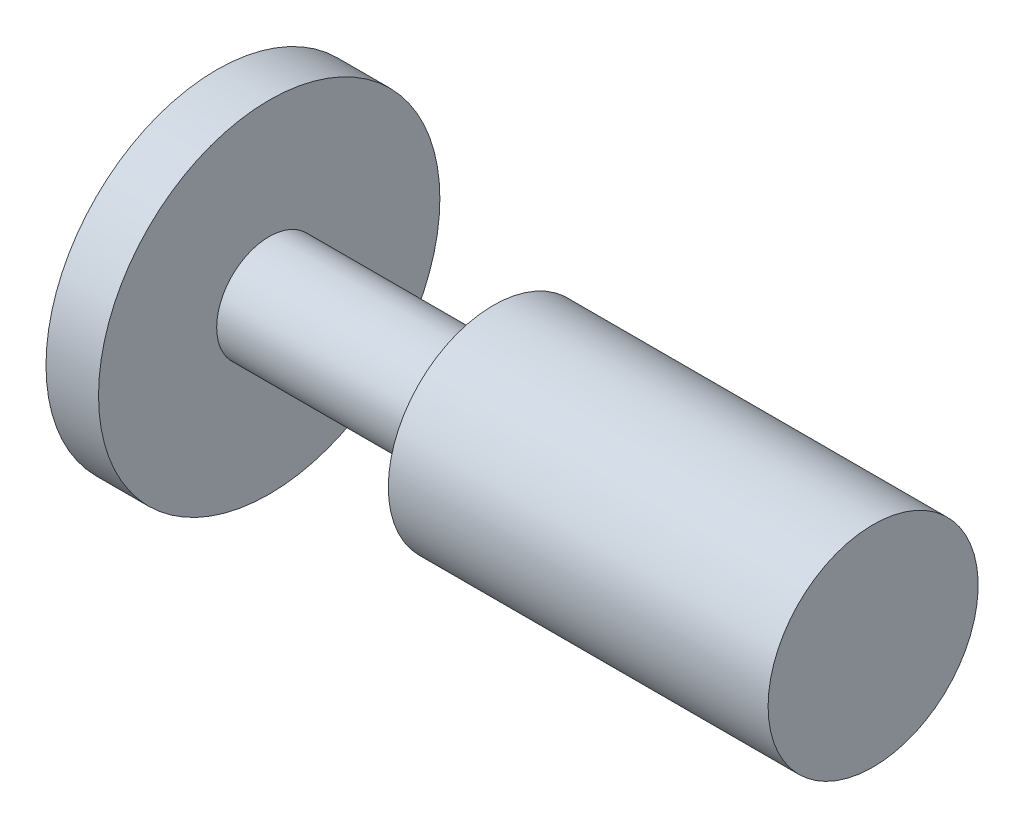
SolidWorks part; units mm, degrees
ref_plane "Plan de face" through (0, 0, 0) normal (0, 0, 1) x (1, 0, 0)
ref_plane "Plan de dessus" through (0, 0, 0) normal (0, 1, 0) x (1, 0, 0)
ref_plane "Plan de droite" through (0, 0, 0) normal (1, 0, 0) x (0, 0, -1)
sketch "Esquisse1" plane through (0, 0, 0) normal (0, 0, 1) x (1, 0, 0)
  line L0 (-18.0553, 0) -> (151.2116, 0) construction
  line L1 (0, 0) -> (0, 32.5)
  line L2 (0, 32.5) -> (10, 32.5)
  line L3 (10, 32.5) -> (10, 10)
  line L4 (10, 10) -> (50, 10)
  line L6 (125, 0) -> (0, 0)
  line L7 (50, 10) -> (52.6795, 20)
  line L8 (52.6795, 20) -> (125, 20)
  line L9 (125, 20) -> (125, 0)
  dimension "D1" = 65
  dimension "D2" = 40
  dimension "D3" = 40
  dimension "D4" = 10
  dimension "D5" = 125
  dimension "D7" = 105
  dimension "D8" = 20
revolve "Révolution1" add sketch "Esquisse1" angle 360 about L0
